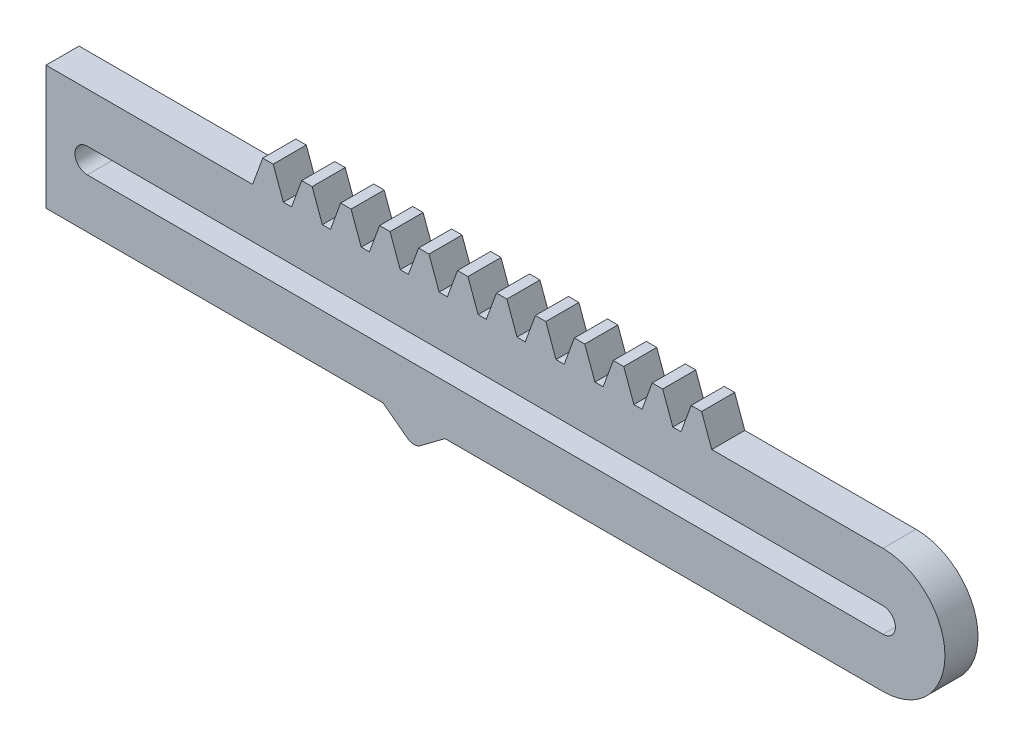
SolidWorks part; units mm, degrees
ref_plane "Plan de face" through (0, 0, 0) normal (0, 0, 1) x (1, 0, 0)
ref_plane "Plan de dessus" through (0, 0, 0) normal (0, 1, 0) x (1, 0, 0)
ref_plane "Plan de droite" through (0, 0, 0) normal (1, 0, 0) x (0, 0, -1)
sketch "Esquisse1" plane through (0, 0, 0) normal (0, 0, 1) x (1, 0, 0)
  line L0 (0, 7.8686) -> (0, 35.51) construction
  line L1 (3.7211, 15) -> (1.2643, 21.75)
  line L2 (-53.7211, 15) -> (-53.7211, -15)
  line L3 (-3.7211, 15) -> (-1.2643, 21.75)
  line L4 (-1.2643, 21.75) -> (1.2643, 21.75)
  line L5 (3.7211, 15) -> (5.7037, 15)
  line L6 (-2.3562, 18.75) -> (0, 18.75) construction
  line L7 (107.3936, 15) -> (148.8231, 15)
  line L8 (-3.7211, 15) -> (-53.7211, 15)
  line L9 (-43.7211, 3) -> (148.8231, 3)
  line L10 (-43.7211, -3) -> (148.8231, -3)
  line L11 (-53.7211, -15) -> (27.8231, -15)
  line L12 (148.8231, -15) -> (148.8231, -20) construction
  line L13 (148.8231, -20) -> (35.3231, -20) construction
  line L14 (35.3231, -20) -> (35.3231, -15) construction
  line L15 (35.3231, -20) -> (32.8231, -20) construction
  line L16 (32.8231, -20) -> (24.3231, -20) construction
  line L17 (27.8231, -15) -> (33.8231, -19.5)
  line L18 (32.8231, -20) -> (32.8231, -18.75) construction
  line L19 (13.1459, 15) -> (10.6891, 21.75)
  line L20 (13.1459, 15) -> (15.1285, 15)
  line L21 (5.7037, 15) -> (8.1605, 21.75)
  line L22 (8.1605, 21.75) -> (10.6891, 21.75)
  line L23 (22.5706, 15) -> (24.5533, 15)
  line L24 (7.0686, 18.75) -> (9.4248, 18.75) construction
  line L25 (22.5706, 15) -> (20.1138, 21.75)
  line L26 (31.9954, 15) -> (33.978, 15)
  line L27 (15.1285, 15) -> (17.5853, 21.75)
  line L28 (17.5853, 21.75) -> (20.1138, 21.75)
  line L29 (41.4202, 15) -> (43.4028, 15)
  line L30 (16.4934, 18.75) -> (18.8496, 18.75) construction
  line L31 (31.9954, 15) -> (29.5386, 21.75)
  line L32 (50.845, 15) -> (52.8276, 15)
  line L33 (24.5533, 15) -> (27.0101, 21.75)
  line L34 (27.0101, 21.75) -> (29.5386, 21.75)
  line L35 (60.2698, 15) -> (62.2524, 15)
  line L36 (25.9181, 18.75) -> (28.2743, 18.75) construction
  line L37 (41.4202, 15) -> (38.9634, 21.75)
  line L38 (69.6945, 15) -> (71.6771, 15)
  line L39 (33.978, 15) -> (36.4348, 21.75)
  line L40 (36.4348, 21.75) -> (38.9634, 21.75)
  line L41 (79.1193, 15) -> (81.1019, 15)
  line L42 (35.3429, 18.75) -> (37.6991, 18.75) construction
  line L43 (50.845, 15) -> (48.3882, 21.75)
  line L44 (88.5441, 15) -> (90.5267, 15)
  line L45 (43.4028, 15) -> (45.8596, 21.75)
  line L46 (45.8596, 21.75) -> (48.3882, 21.75)
  line L47 (97.9689, 15) -> (99.9515, 15)
  line L48 (44.7677, 18.75) -> (47.1239, 18.75) construction
  line L49 (60.2698, 15) -> (57.813, 21.75)
  line L51 (52.8276, 15) -> (55.2844, 21.75)
  line L52 (55.2844, 21.75) -> (57.813, 21.75)
  line L54 (54.1925, 18.75) -> (56.5487, 18.75) construction
  line L55 (69.6945, 15) -> (67.2377, 21.75)
  line L57 (62.2524, 15) -> (64.7092, 21.75)
  line L58 (64.7092, 21.75) -> (67.2377, 21.75)
  line L59 (42.8231, -15) -> (36.8231, -19.5)
  line L60 (63.6173, 18.75) -> (65.9734, 18.75) construction
  line L61 (79.1193, 15) -> (76.6625, 21.75)
  line L62 (42.8231, -15) -> (148.8231, -15)
  line L63 (71.6771, 15) -> (74.1339, 21.75)
  line L64 (74.1339, 21.75) -> (76.6625, 21.75)
  line L66 (73.042, 18.75) -> (75.3982, 18.75) construction
  line L67 (88.5441, 15) -> (86.0873, 21.75)
  line L69 (81.1019, 15) -> (83.5587, 21.75)
  line L70 (83.5587, 21.75) -> (86.0873, 21.75)
  line L72 (82.4668, 18.75) -> (84.823, 18.75) construction
  line L73 (97.9689, 15) -> (95.5121, 21.75)
  line L75 (90.5267, 15) -> (92.9835, 21.75)
  line L76 (92.9835, 21.75) -> (95.5121, 21.75)
  line L78 (91.8916, 18.75) -> (94.2478, 18.75) construction
  line L79 (107.3936, 15) -> (104.9368, 21.75)
  line L81 (99.9515, 15) -> (102.4083, 21.75)
  line L82 (102.4083, 21.75) -> (104.9368, 21.75)
  line L84 (101.3164, 18.75) -> (103.6726, 18.75) construction
  line L104 (148.8231, 0) -> (-14.7124, 0) construction
  line L105 (135.668, 15) -> (133.2112, 21.75)
  line L106 (130.6826, 21.75) -> (133.2112, 21.75)
  line L107 (129.5907, 18.75) -> (131.9469, 18.75) construction
  line L108 (128.2258, 15) -> (130.6826, 21.75)
  line L109 (116.8184, 15) -> (114.3616, 21.75)
  line L110 (109.3763, 15) -> (111.8331, 21.75)
  line L111 (111.8331, 21.75) -> (114.3616, 21.75)
  line L112 (126.2432, 15) -> (123.7864, 21.75)
  line L113 (118.801, 15) -> (121.2578, 21.75)
  line L114 (110.7411, 18.75) -> (113.0973, 18.75) construction
  line L115 (120.1659, 18.75) -> (122.5221, 18.75) construction
  line L116 (121.2578, 21.75) -> (123.7864, 21.75)
  arc A0 (148.8231, 15) -> (148.8231, -15) centre (148.8231, 0) cw
  arc A1 (148.8231, -3) -> (148.8231, 3) centre (148.8231, 0) ccw
  arc A2 (-43.7211, 3) -> (-43.7211, -3) centre (-43.7211, 0) ccw
  arc A3 (33.8231, -19.5) -> (36.8231, -19.5) centre (35.3231, -17.5) ccw
  point P11 (0, 21.75)
  point P13 (122.5221, 21.75)
  point P15 (113.0973, 21.75)
  point P25 (131.9469, 21.75)
  point P35 (9.4248, 21.75)
  point P38 (-53.7211, 0)
  point P44 (18.8496, 21.75)
  point P53 (28.2743, 21.75)
  point P62 (37.6991, 21.75)
  point P71 (47.1239, 21.75)
  point P80 (56.5487, 21.75)
  point P89 (65.9734, 21.75)
  point P98 (75.3982, 21.75)
  point P107 (84.823, 21.75)
  point P116 (94.2478, 21.75)
  point P125 (103.6726, 21.75)
  dimension "D14" = 9.4248
  dimension "D2" = 15
  dimension "D3" = 5
  dimension "D4" = 50
  dimension "D5" = 3
  dimension "D6" = 2.3562
  dimension "D7" = 202.5442
  dimension "D10" = 2.5286
  dimension "D13" = 15
extrude "Boss.-Extru.1" add sketch "Esquisse1" along normal blind 8
